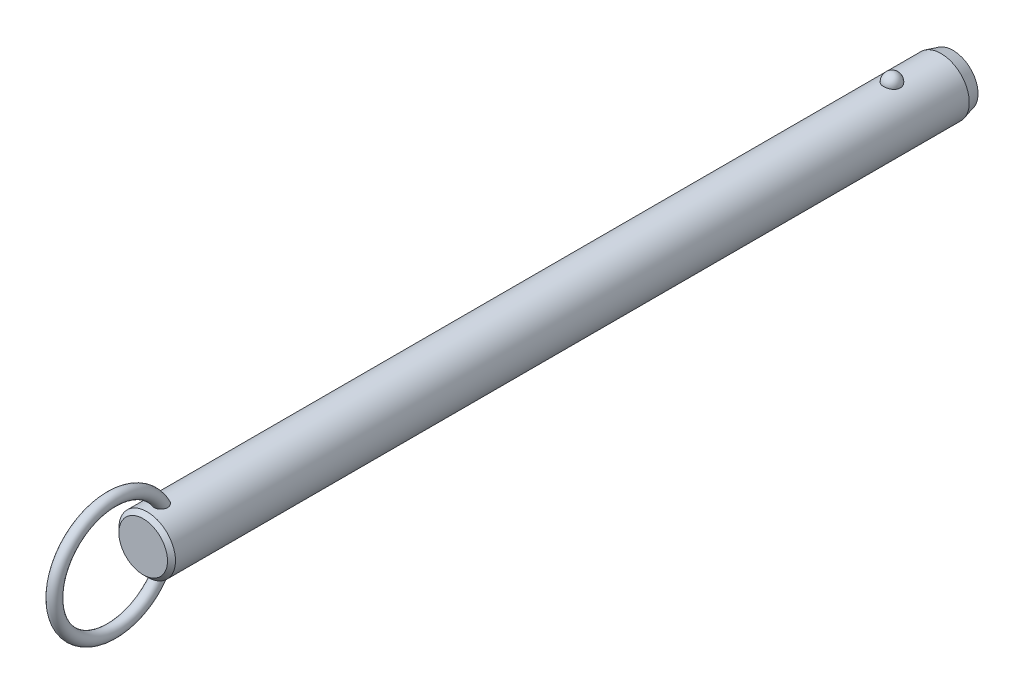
SolidWorks part; units mm, degrees
ref_plane "Front Plane" through (0, 0, 0) normal (0, 0, 1) x (1, 0, 0)
ref_plane "Top Plane" through (0, 0, 0) normal (0, 1, 0) x (1, 0, 0)
ref_plane "Right Plane" through (0, 0, 0) normal (1, 0, 0) x (0, 0, -1)
sketch "Sketch2" plane through (0, 0, 0) normal (0, 0, 1) x (1, 0, 0)
  circle A0 centre (0, 0) radius 7.1
  point P3 (0, 7.1)
  dimension "D1" = 14.2
extrude "Boss-Extrude1" add sketch "Sketch2" along normal blind 177.8
sketch "Sketch3" plane through (0, 0, 0) normal (0, 0, -1) x (-1, 0, 0)
  circle A0 centre (0, 0) radius 7.1
  dimension "D1" = 14.2
extrude "Boss-Extrude2" add sketch "Sketch3" along normal blind 17.4
chamfer "Chamfer1" distance 3 angle 15 1 edges at (-7.1, 0, -17.4)
sketch "Sketch12" plane through (0, 0, 0) normal (1, 0, 0) x (0, 0, -1)
  line L0 (-177.8, 7.1) -> (-177.8, -7.1) construction
  point P0 (-177.8, 0)
sketch "Sketch13" plane through (0, 0, 0) normal (1, 0, 0) x (0, 0, -1)
  circle A0 centre (-193.65, 0) radius 15.85
  point P2 (-177.8, 0)
  dimension "D1" = 31.7
sketch "Sketch14" plane through (0, 0, 0) normal (0, 1, 0) x (1, 0, 0)
  circle A0 centre (0, -179.3) radius 1.5
  point P2 (0, -177.8)
  dimension "D1" = 3
sweep "Sweep1" add profiles "Sketch14" path "Sketch13"
sketch "Sketch15" plane through (0, 0, 177.8) normal (0, 0, 1) x (1, 0, 0)
  circle A0 centre (0, 0) radius 7.1
  dimension "D1" = 14.2
extrude "Boss-Extrude3" add sketch "Sketch15" along normal blind 7.92
chamfer "Chamfer2" distance 1 angle 45 1 edges at (7.1, 0, 185.72)
sketch "Sketch18" plane through (0, 0, 0) normal (1, 0, 0) x (0, 0, -1)
  line L0 (14.4, 7.1) -> (-179.4792, 7.1) construction
  line L1 (2.1, 9.2) -> (2.1, 5)
  line L2 (-179.4792, -7.1) -> (14.4, -7.1) construction
  arc A0 (2.1, 9.2) -> (2.1, 5) centre (2.1, 7.1) ccw
  point P4 (0, 7.1)
  dimension "D1" = 16.3
revolve "Revolve1" add sketch "Sketch18" angle 360 about L1
